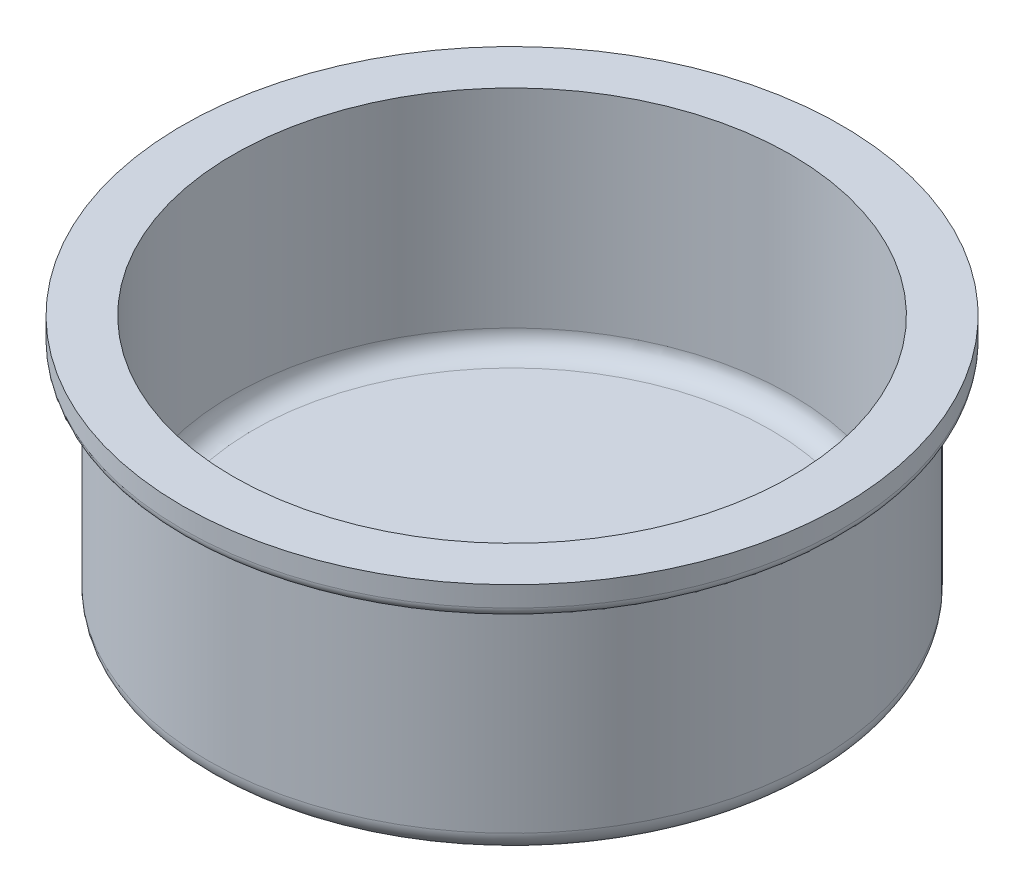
SolidWorks part; units mm, degrees
ref_plane "Front" through (0, 0, 0) normal (0, 0, 1) x (1, 0, 0)
ref_plane "Top" through (0, 0, 0) normal (0, 1, 0) x (1, 0, 0)
ref_plane "Right" through (0, 0, 0) normal (1, 0, 0) x (0, 0, -1)
sketch "Esquisse1" plane through (0, 0, 0) normal (0, 0, 1) x (1, 0, 0)
  line L0 (0, 0) -> (30, 0)
  line L1 (30, 0) -> (30, 22)
  line L2 (30, 22) -> (32.5, 22)
  line L3 (32.5, 22) -> (32.5, 25)
  line L4 (32.5, 25) -> (27.5, 25)
  line L5 (27.5, 25) -> (27.5, 2.5)
  line L6 (27.5, 2.5) -> (0, 2.5)
  line L7 (0, 54.194) -> (0, -28.5096) construction
  line L8 (0, 2.5) -> (0, 0)
  point P12 (0, 2.5)
  point P17 (0, 0)
  dimension "D1" = 60
  dimension "D2" = 55
  dimension "D3" = 25
  dimension "D4" = 3
  dimension "D5" = 2.5
  dimension "D6" = 2.5
  dimension "D7" = 65
revolve "Révolution1" add sketch "Esquisse1" angle 360 about L7
fillet "Congé1" radius 2 2 edges at (0, 0, 30) (0, 2.5, 27.5)
fillet "Congé2" radius 1 2 edges at (0, 22, 32.5) (0, 22, 30)
